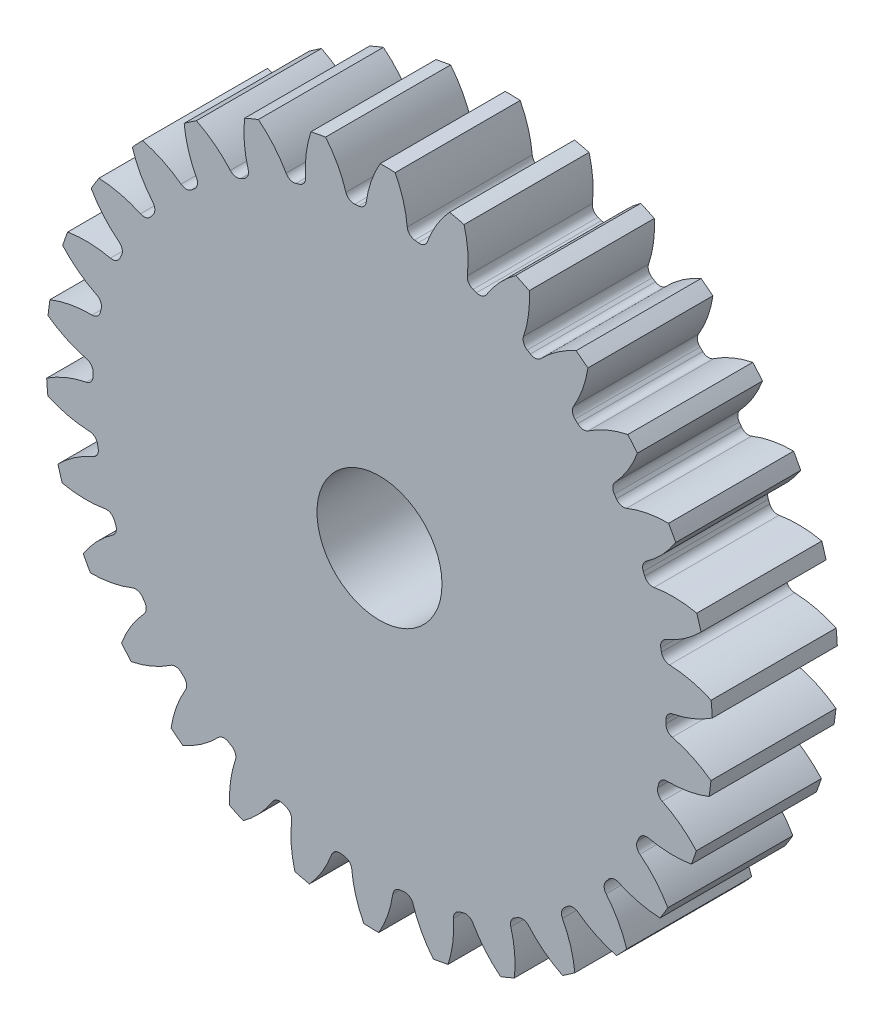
SolidWorks part; units mm, degrees
ref_plane "Front" through (0, 0, 0) normal (0, 0, 1) x (1, 0, 0)
ref_plane "Top" through (0, 0, 0) normal (0, 1, 0) x (1, 0, 0)
ref_plane "Right" through (0, 0, 0) normal (1, 0, 0) x (0, 0, -1)
sketch "Sketch3" plane through (0, 0, 0) normal (0, 0, 1) x (1, 0, 0)
  circle A0 centre (0, 0) radius 270.9333
  dimension "od" = 541.8667
extrude "gearBody" add sketch "Sketch3" along normal blind 101.6
sketch "Sketch2" plane through (0, 0, 0) normal (0, 0, 1) x (1, 0, 0)
  line L0 (0, 0) -> (220.5133, 91.3396) construction
  line L1 (269.8187, -29.2621) -> (0, 0) construction
  line L2 (0, 0) -> (36.3143, 0) construction
  line L3 (253.9038, 6.9896) -> (253.2504, -19.5) construction
  line L5 (253.5771, -6.2552) -> (0, 0) construction
  line L7 (0, 0) -> (238.6819, 0) construction
  arc A0 (238.6693, 2.4565) -> (238.2579, -14.2212) centre (0, 0) ccw construction
  arc A1 (270.4825, 15.6235) -> (269.3832, -28.9408) centre (0, 0) ccw construction
  arc A2 (253.9038, 6.9896) -> (253.2504, -19.5) centre (0, 0) ccw construction
  arc A3 (232.7208, -7.2394) -> (232.7947, -4.2438) centre (0, 0) ccw
  arc A4 (269.8187, -29.2621) -> (237.9241, -14.1364) centre (215.7416, -102.1011) ccw
  arc A5 (269.8187, -29.2621) -> (270.9333, 15.9229) centre (0, 0) ccw
  arc A6 (270.9333, 15.9229) -> (238.3317, 2.3882) centre (220.5133, 91.3396) cw
  arc A7 (232.7947, -4.2438) -> (238.3317, 2.3882) centre (239.6854, -4.3694) cw
  arc A8 (237.9241, -14.1364) -> (232.7208, -7.2394) centre (239.6093, -7.4537) cw
  point P6 (270.9333, 15.9229)
  point P22 (269.8187, -29.2621)
  dimension "baseDia" = 477.3639
  dimension "od" = 541.8667
  dimension "pd" = 508
  dimension "rd" = 465.6667
  dimension "rFillet" = 6.8919
  dimension "pointX" = 270.9333
  dimension "pointY" = 15.9229
  dimension "CTT" = 26.4896
  dimension "flankCenterAngle" = 22.5
extrude "toothCut" cut sketch "Sketch2" along normal through all
pattern_circular "CirPattern1" count 30 over 360 about axis through (0, 0, 0) along (0, 0, 1) of "toothCut"
sketch "hub1Dia" plane through (0, 0, 0) normal (0, 0, -1) x (-1, 0, 0)
  circle A0 centre (0, 0) radius 12.7
  dimension "hub1Dia" = 25.4
sketch "hub2Dia" plane through (0, 0, 101.6) normal (0, 0, 1) x (1, 0, 0)
  circle A0 centre (0, 0) radius 12.7
  dimension "hub2dia" = 25.4
sketch "boreDia" plane through (0, 0, 0) normal (0, 0, 1) x (1, 0, 0)
  circle A0 centre (0, 0) radius 50.8
  dimension "boreDia" = 101.6
extrude "bore" cut sketch "boreDia" against normal mid plane 25400
